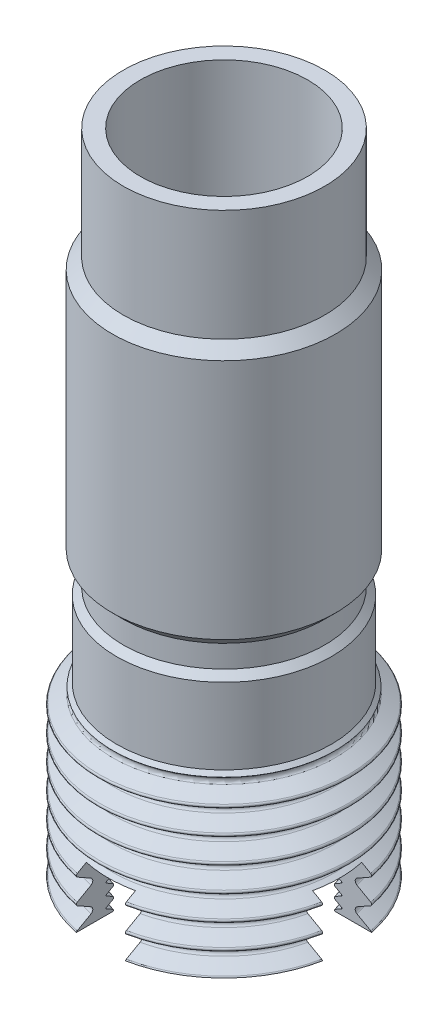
SolidWorks part; units mm, degrees
ref_plane "Front Plane" through (0, 0, 0) normal (0, 0, 1) x (1, 0, 0)
ref_plane "Top Plane" through (0, 0, 0) normal (0, 1, 0) x (1, 0, 0)
ref_plane "Right Plane" through (0, 0, 0) normal (1, 0, 0) x (0, 0, -1)
sketch "Sketch1" plane through (0, 0, 0) normal (0, 0, 1) x (1, 0, 0)
  line L0 (0, 0) -> (0, 31.3505) construction
  line L1 (-4.7625, 0) -> (-4.7625, 15.875)
  line L2 (-4.7625, 0) -> (-7.1438, 0)
  line L3 (-7.1438, 0) -> (-7.1437, 8.49)
  line L4 (-7.1437, 8.49) -> (-6.1087, 9.525)
  line L5 (-6.1087, 9.525) -> (-6.1087, 13.843)
  line L6 (-5.7277, 15.494) -> (-6.35, 16.1163)
  line L7 (-5.7277, 36.83) -> (-5.7277, 30.48)
  line L8 (-5.7277, 30.48) -> (-6.35, 29.8577)
  line L9 (-6.35, 16.1163) -> (-6.35, 29.8577)
  line L10 (-5.7277, 36.83) -> (-4.7625, 36.83)
  line L11 (-5.7277, 15.494) -> (-5.7277, 14.224)
  line L12 (-5.7277, 14.224) -> (-6.1087, 13.843)
  line L13 (-4.7625, 15.875) -> (-2.4257, 15.875)
  line L14 (-2.4257, 15.875) -> (-2.4257, 23.9959)
  line L15 (-2.4257, 23.9959) -> (-4.7625, 25.4)
  line L16 (-4.7625, 25.4) -> (-4.7625, 36.83)
  dimension "D1" = 14.2875
  dimension "D2" = 9.525
  dimension "D3" = 12.2174
  dimension "D4" = 45
  dimension "D5" = 27.305
  dimension "D6" = 1.27
  dimension "D7" = 12.7
  dimension "D8" = 36.83
  dimension "D9" = 11.4554
  dimension "D10" = 6.35
  dimension "D11" = 21.336
  dimension "D12" = 59
  dimension "D13" = 4.8514
  dimension "D14" = 15.875
  dimension "D15" = 25.4
revolve "Revolve1" add sketch "Sketch1" angle 360 about L0
ref_axis "Axis1" through (0, 15.4479, 0) along (0, -1, 0)
sketch "Sketch3" plane through (0, 0, 0) normal (0, 0, 1) x (1, 0, 0)
  line L0 (0, 0) -> (0, -6.3978) construction
  line L1 (-6.329, 9.3204) -> (-6.329, 8.9676) construction
  line L2 (-4.7625, 0) -> (4.7625, 0) construction
  line L3 (-6.329, 8.9676) -> (-6.0235, 9.144) construction
  line L4 (-6.0235, 9.144) -> (-6.329, 9.3204) construction
  line L6 (-7.0928, 8.5266) -> (-6.329, 8.9676)
  line L8 (-6.329, 9.3204) -> (-7.0928, 9.7614)
  line L9 (-7.1437, 9.8496) -> (-7.1437, 8.4384)
  line L10 (-6.2272, 9.144) -> (0, 9.144) construction
  line L13 (0, 9.144) -> (6.2272, 9.144) construction
  line L14 (0, 15.4479) -> (0, -2.4123) construction
  arc A0 (-6.329, 9.3204) -> (-6.329, 8.9676) centre (-6.4309, 9.144) cw
  arc A1 (-7.1437, 9.8496) -> (-7.0928, 9.7614) centre (-7.0419, 9.8496) ccw
  arc A2 (-7.0928, 8.5266) -> (-7.1437, 8.4384) centre (-7.0419, 8.4384) ccw
  arc A3 (-7.1437, 8.4384) -> (-7.0928, 8.3502) centre (-7.0419, 8.4384) ccw construction
  point P6 (-6.0235, 9.144)
  dimension "D2" = 0.1764
  dimension "D4" = 12.4544
  dimension "D5" = 1.4111
  dimension "D6" = 0.3528
  dimension "D1" = 12.0471
  dimension "D3" = 60
  dimension "D7" = 9.144
  dimension "D9" = 14.2875
revolve "Outer thread" cut sketch "Sketch3" angle 360 about L0
pattern_linear "LPattern1" count 7 spacing 1.4111 along (0, -1, 0) of "Outer thread"
sketch "Sketch4" plane through (0, 0, 0) normal (0, 0, 1) x (1, 0, 0)
  line L0 (-5.08, 5.7436) -> (-5.08, 5.1086) construction
  line L1 (-5.1258, 5.1879) -> (-5.4695, 5.3864)
  line L2 (-5.4695, 5.4658) -> (-5.1258, 5.6642)
  line L3 (-5.1258, 5.1879) -> (-5.1258, 5.0292) construction
  line L4 (0, 0) -> (0, -4.5846) construction
  line L5 (0, 15.4479) -> (0, -2.4123) construction
  line L7 (-5.08, 6.35) -> (0, 15.1488)
  line L8 (0, 15.1488) -> (0, 0)
  line L9 (0, 0) -> (-5.08, 0)
  line L10 (-5.08, 5.1086) -> (-5.08, 0)
  line L11 (-5.4695, 5.4658) -> (-5.4695, 5.3864) construction
  line L12 (-5.08, 5.7436) -> (-5.08, 6.35)
  arc A0 (-5.4695, 5.4658) -> (-5.4695, 5.3864) centre (-5.4466, 5.4261) ccw
  arc A1 (-5.1258, 5.6642) -> (-5.08, 5.7436) centre (-5.1717, 5.7436) ccw
  arc A2 (-5.08, 5.1086) -> (-5.1258, 5.1879) centre (-5.1717, 5.1086) ccw
  arc A3 (-5.08, 5.1086) -> (-5.1258, 5.0292) centre (-5.1717, 5.1086) cw construction
  dimension "D1" = 60
  dimension "D6" = 0.0794
  dimension "D9" = 0.1588
  dimension "D2" = 10.16
  dimension "D3" = 0.635
  dimension "D4" = 5.4261
  dimension "D5" = 30
  dimension "D7" = 10.9391
  dimension "D8" = 6.35
revolve "Inner thread" cut sketch "Sketch4" angle 360 about axis through (0, 15.4479, 0) along (0, -1, 0)
pattern_linear "LPattern2" count 9 spacing 0.635 along (0, -1, 0) of "Inner thread"
sketch "Sketch2" plane through (0, 0, 0) normal (0, -1, 0) x (1, 0, 0)
  line L0 (1.397, 1.397) -> (9.3236, 1.397)
  line L1 (-1.397, -8.9729) -> (1.397, -8.9729)
  line L2 (-1.397, -8.9729) -> (-1.397, -1.397)
  line L3 (-1.397, 9.3254) -> (1.397, 9.3254)
  line L4 (1.397, -8.9729) -> (1.397, -1.397)
  line L5 (-11.306, 1.397) -> (-1.397, 1.397)
  line L6 (-11.306, 1.397) -> (-11.306, -1.397)
  line L7 (-11.306, -1.397) -> (-1.397, -1.397)
  line L8 (9.3236, 1.397) -> (9.3236, -1.397)
  line L9 (-1.397, 1.397) -> (-1.397, 9.3254)
  line L10 (1.397, -1.397) -> (9.3236, -1.397)
  line L11 (1.397, 1.397) -> (1.397, 9.3254)
  line L12 (-1.397, -1.397) -> (1.397, 1.397) construction
  dimension "D1" = 2.794
extrude "Extrude1" cut sketch "Sketch2" against normal blind 3.175
sketch "Sketch5" plane through (0, 0, 0) normal (0, 0, 1) x (1, 0, 0)
  line L0 (0, 0) -> (0, 22.3857) construction
  line L1 (0, 15.4479) -> (0, -2.4123) construction
  line L2 (-6.1087, 9.525) -> (-7.1501, 8.4836)
  line L3 (6.1087, 9.525) -> (-6.1087, 9.525) construction
  line L4 (-7.1501, 8.4836) -> (-7.1501, 0)
  line L5 (-7.1501, 0) -> (-5.08, 0)
  line L6 (-5.08, 0) -> (-5.08, 6.35)
  line L7 (5.08, 6.35) -> (-5.08, 6.35) construction
  line L8 (-5.08, 6.35) -> (-6.1087, 9.525)
  line L9 (-7.0018, 0) -> (-4.8841, 0) construction
  line L10 (-6.1087, 9.525) -> (-5.747, 9.525) construction
  dimension "D1" = 45
  dimension "D2" = 14.3002
  dimension "D3" = 10.16
  dimension "D4" = 12.2174
revolve "Revolve2" [suppressed] add sketch "Sketch5" angle 360 about L0
equation "\"D2@Sketch3\"=\"D5@Sketch3\"*.125"
equation "\"D6@Sketch3\"=\"D5@Sketch3\"*.25"
equation "\"D6@Sketch4\"=\"D3@Sketch4\"*.125"
equation "\"D9@Sketch4\"=\"D3@Sketch4\"*.25"
